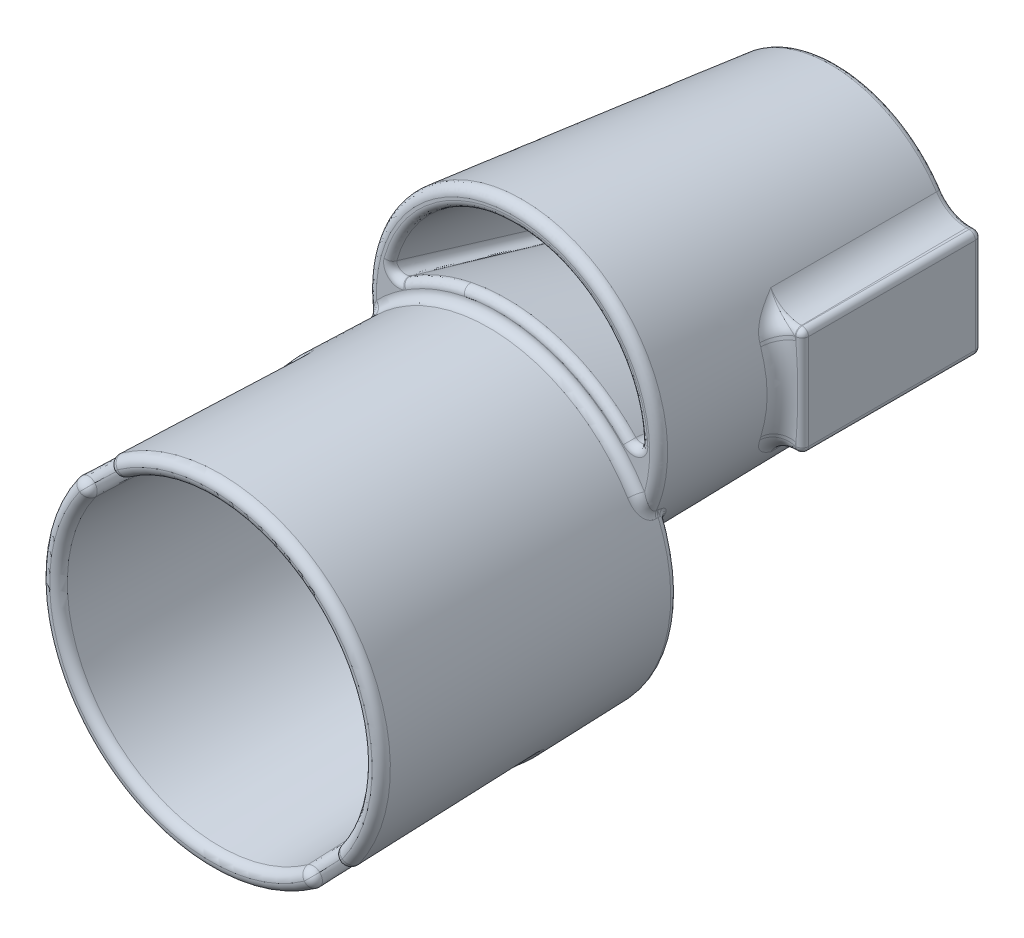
SolidWorks part; units mm, degrees
ref_plane "Front Plane" through (0, 0, 0) normal (0, 0, 1) x (1, 0, 0)
ref_plane "Top Plane" through (0, 0, 0) normal (0, 1, 0) x (1, 0, 0)
ref_plane "Right Plane" through (0, 0, 0) normal (1, 0, 0) x (0, 0, -1)
ref_plane "Overlap Plane" through (0, 0, 85) normal (0, 0, 1) x (1, 0, 0)
sketch "Sketch2" plane through (0, 0, 0) normal (0, 0, 1) x (1, 0, 0)
  circle A4 centre (-38.75, 0) radius 35.25 construction
  circle A5 centre (-38.75, 0) radius 35.25
sketch "Sketch3" plane through (0, 0, 85) normal (0, 0, 1) x (1, 0, 0)
  circle A3 centre (-44.25, 0) radius 40.75 construction
  circle A4 centre (-44.25, 0) radius 40.75
loft "Car Cupholder" add profiles "Sketch2", "Sketch3"
sketch "Sketch13" plane through (0, 0, 0) normal (0, 0, 1) x (1, 0, 0)
  line L1 (-8.5, -15) -> (1.5, -15)
  line L2 (-8.5, -15) -> (-8.5, 15)
  line L3 (-8.5, 15) -> (1.5, 15)
  line L4 (1.5, -15) -> (1.5, 15)
  line L5 (-8.5, -15) -> (1.5, 15) construction
  line L6 (-8.5, 15) -> (1.5, -15) construction
  circle A1 centre (-44.25, 0) radius 40.75 construction
  point P0 (-3.5, 0)
  dimension "D1" = 10
  dimension "D2" = 30
extrude "Alignment Peg" add sketch "Sketch13" along normal blind 50
fillet "Alignment Peg Fillet" radius 10 2 edges at (-6.6894, 15, 25) (-6.6894, -15, 24.9999)
fillet "Alignment Peg Fillet Edges" radius 1.75 13 edges at (0.5291, 15, 50) (0.5291, -15, 50) (1.5, 15, 25) (1.5, -15, 25) (1.5, 0, 50) (1.5, 0, 0) (-3.7522, 15.5638, 50) (-7.0698, 17.0278, 0) (-4.343, -15.5638, 0) (-6.8208, -17.2985, 50)
sketch "Cup Base" plane through (0, 0, 80) normal (0, 0, 1) x (1, 0, 0)
  circle A0 centre (-48.25, -35) radius 40 construction
  circle A1 centre (-44.25, 0) radius 40.75 construction
  circle A2 centre (-48.25, -35) radius 45
  point P2 (-44.25, 0)
  point P7 (-48.25, 10)
  point P8 (0, 0)
  point P9 (-49.5239, -35)
  dimension "D3" = 80
  dimension "D1" = 4
  dimension "D2" = 35
  dimension "D4" = 5
shell "Test Print Shell" [suppressed] thickness 0.6
ref_plane "Bottom of tumbler holder" through (0, 0, 165) normal (0, 0, 1) x (1, 0, 0)
sketch "Sketch7" plane through (0, 0, 165) normal (0, 0, 1) x (1, 0, 0)
  circle A0 centre (-48.25, -35) radius 42.5 construction
  circle A1 centre (-48.25, -35) radius 47.5
  point P6 (-48.25, 12.5)
  dimension "D1" = 85
  dimension "D2" = 5
loft "Tumbler Holder Body" add profiles "Cup Base", "Sketch7"
sketch "Sketch8" plane through (0, 0, 165) normal (0, 0, 1) x (1, 0, 0)
  circle A0 centre (-48.25, -35) radius 42.5 construction
  circle A1 centre (-48.25, -35) radius 42.5
  point P3 (-48.25, 7.5)
ref_plane "Tumbler Bottom Plane" through (0, 0, 85) normal (0, 0, 1) x (1, 0, 0)
sketch "Sketch9" plane through (0, 0, 85) normal (0, 0, 1) x (1, 0, 0)
  circle A0 centre (-48.25, -35) radius 40 construction
  circle A1 centre (-48.25, -35) radius 40
  point P3 (-48.25, 5)
loft "Tumbler Cavity" cut profiles "Sketch9", "Sketch8"
ref_plane "Tumbler Slice Plane" through (0, 0, 110) normal (0, 0, 1) x (1, 0, 0)
sketch "Sketch12" plane through (0, 0, 110) normal (0, 0, 1) x (1, 0, 0)
  line L0 (-18.198, -72.1231) -> (-85.3731, -4.948)
  line L1 (-18.198, -72.1231) -> (-11.1269, -65.052)
  line L2 (-85.3731, -4.948) -> (-78.302, 2.1231)
  line L3 (-11.1269, -65.052) -> (-78.302, 2.1231)
  line L4 (-18.198, -72.1231) -> (-78.302, 2.1231) construction
  line L5 (-85.3731, -4.948) -> (-11.1269, -65.052) construction
  line L6 (-48.25, -35) -> (-48.25, 5) construction
  circle A0 centre (-48.25, -35) radius 40 construction
  circle A1 centre (-48.25, -35) radius 47.5 construction
  point P1 (-48.25, -35)
  dimension "D1" = 10
  dimension "D2" = 45
extrude "Tumbler Slot" cut sketch "Sketch12" along normal through all
fillet "Top Fillets" radius 2.5 28 edges at (-15.8063, -67.4437, 110) (-80.6937, -2.5563, 110) (-77.0867, -6.1633, 110) (-19.4133, -63.8367, 110) (-21.3507, -68.9704, 110) (-82.2204, -8.1007, 110) (-14.2796, -61.8993, 110) (-75.1493, -1.0296, 110) (-78.302, -65.052, 165) (-18.198, -4.948, 165)
fillet "Fillet3" radius 2 3 edges at (-83.9183, -7.2319, 80) (-6.8991, -16.7334, 80)
sketch "Sketch14" plane through (0, 0, 85) normal (0, 0, 1) x (1, 0, 0)
  arc A2 (-8.727, -4.0137) -> (-79.3819, 4.4084) centre (-48.25, -35) ccw
  arc A4 (-8.727, -4.0137) -> (-79.3819, 4.4084) centre (-48.25, -35) ccw
  spline S2 degree 3 number of poles 66 (-8.727, -4.0137) -> (-79.3819, 4.4084)
  spline S3 degree 3 number of poles 66 (-8.727, -4.0137) -> (-79.3819, 4.4084)
  dimension "D1" = 2.5
ref_plane "Coin Cavity Bottom Plane" through (0, 0, 10) normal (0, 0, 1) x (1, 0, 0)
sketch "Sketch15" plane through (0, 0, 10) normal (0, 0, 1) x (1, 0, 0)
  arc A2 (-9.9172, -9.1506) -> (-67.5828, -9.1506) centre (-38.75, -50) ccw
  circle A3 centre (-38.75, 0) radius 30.25
  arc A4 (-9.9172, -9.1506) -> (-67.5828, -9.1506) centre (-38.75, 0) ccw
  dimension "D2" = 100
  dimension "D3" = 50
  dimension "D1" = 5
loft "Coin Cavity" cut profiles "Sketch14", "Sketch15"
fillet "Coin Cavity Fillets" radius 2 4 edges
fillet "Fillet7" radius 2 4 edges at (-77.7375, 7.6011, 85) (-10.0246, -0.8379, 85)
fillet "Cup to Tumbler Fillet 2" radius 2 5 edges at (-7.21, -16.9296, 80.8568) (-37.9759, -39.9861, 80)
fillet "Fillet6" radius 5 3 edges at (-7.4455, -16.9681, 49.6061) (-7.4455, 16.9681, 49.6061) (-3.5763, -2.4248, 50)
